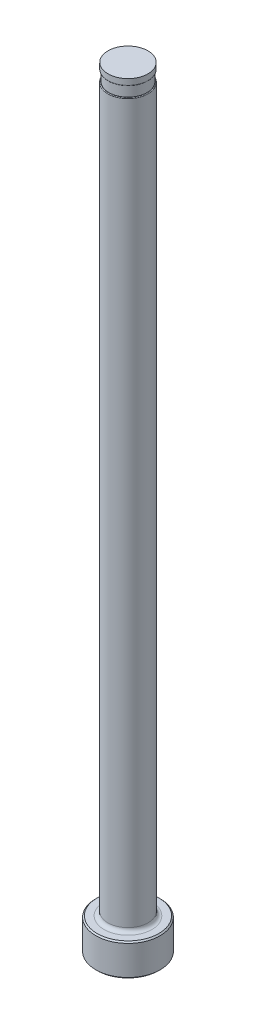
SolidWorks part; units mm, degrees
ref_plane "Front Plane" through (0, 0, 0) normal (0, 0, 1) x (1, 0, 0)
ref_plane "Top Plane" through (0, 0, 0) normal (0, 1, 0) x (1, 0, 0)
ref_plane "Right Plane" through (0, 0, 0) normal (1, 0, 0) x (0, 0, -1)
other "Configuration Table"
sketch "Sketch1" plane through (0, 0, 0) normal (0, 0, 1) x (1, 0, 0)
  line L0 (0, 259.9588) -> (0, -15.1925) construction
  line L1 (0, 0) -> (-6.35, 0)
  line L2 (-6.35, 0) -> (-6.35, 6.35)
  line L3 (-6.35, 6.35) -> (-3.9687, 6.35)
  line L4 (-3.9687, 6.35) -> (-3.9687, 152.4)
  line L5 (-3.9687, 152.4) -> (0, 152.4)
  line L6 (0, 152.4) -> (0, 0)
  dimension "L" = 152.4
  dimension "H" = 12.7
  dimension "T" = 6.35
  dimension "D" = 7.9375
revolve "Revolve1" add sketch "Sketch1" angle 360 about L0
chamfer "Chamfer1" distance 0.254 angle 45 2 edges at (0, 6.35, 6.35) (0, 0, 6.35)
fillet "Fillet1" radius 0.762 1 edges at (0, 6.35, 3.9687)
sketch "Sketch2" plane through (0, 0, 0) normal (0, 0, 1) x (1, 0, 0)
  line L0 (-3.9687, 152.4) -> (-3.9687, 7.112) construction
  line L1 (-3.9687, 151.13) -> (-3.7655, 151.13)
  line L2 (-3.9687, 151.13) -> (-3.9687, 149.098)
  line L3 (-3.9687, 149.098) -> (-3.7655, 149.098)
  line L4 (-3.7655, 151.13) -> (-3.7655, 149.098)
  line L5 (3.9687, 152.4) -> (-3.9687, 152.4) construction
  line L6 (0, 153.4483) -> (0, 147.3282) construction
  dimension "D1" = 2.032
  dimension "N" = 1.27
  dimension "FD" = 0.2032
  dimension "D3" = 7.5311
revolve "Vent Relief" cut sketch "Sketch2" angle 360 about L6
sketch "Sketch3" plane through (0, 0, 0) normal (0, 0, 1) x (1, 0, 0)
  line L0 (-3.7655, 150.114) -> (-3.7655, 86.614)
  line L1 (-3.7655, 151.13) -> (-3.7655, 149.098) construction
  line L2 (-3.9687, 149.098) -> (-3.9687, 7.112) construction
  line L3 (-3.9687, 85.4964) -> (-3.9687, 150.114)
  line L4 (-3.9687, 150.114) -> (-3.7655, 150.114)
  arc A0 (-3.7655, 86.614) -> (-3.9687, 85.4964) centre (-6.9405, 86.614) cw
  dimension "D1" = 3.175
  dimension "D2" = 63.5
extrude "D-Slot" cut sketch "Sketch3" against normal through all both and the other way through all
sketch "Sketch5" plane through (0, 0, 0) normal (0, 0, 1) x (1, 0, 0)
  line L0 (-3.9687, 151.13) -> (3.9687, 151.13) construction
  line L1 (-3.9687, 152.4) -> (-3.9497, 152.4)
  line L2 (-3.9687, 152.4) -> (-3.9687, 151.13)
  line L3 (-3.9687, 151.13) -> (-3.9497, 151.13)
  line L4 (-3.9497, 152.4) -> (-3.9497, 151.13)
  line L5 (0, 152.6877) -> (0, 150.5771) construction
  dimension "VP" = 0.019
revolve "Vent Diameter" cut sketch "Sketch5" angle 360 about L5
fillet "Fillet2" radius 0.127 2 edges at (3.9687, 149.098, 0) (0, 151.13, 3.9497)
sketch "Pocket Sketch" plane through (0, 0, 0) normal (0, 0, 1) x (1, 0, 0)
  line L0 (-6.7469, 0) -> (-6.7469, 6.3754)
  line L1 (-6.7469, 6.3754) -> (-4.9292, 6.3754)
  line L2 (-4.1672, 7.1374) -> (-4.1672, 22.225)
  line L3 (-4.1672, 22.225) -> (0, 22.225)
  line L4 (0, 22.225) -> (0, 0)
  line L5 (0, 0) -> (-6.7469, 0)
  line L6 (0, 12.6104) -> (0, -2.4989) construction
  line L7 (-6.35, 6.096) -> (-6.35, 0.254) construction
  line L8 (6.096, 6.35) -> (-6.096, 6.35) construction
  line L9 (-3.9687, 85.4964) -> (-3.9687, 7.112) construction
  line L10 (-4.9292, 6.3754) -> (-4.1672, 7.1374)
  point P3 (-4.1672, 6.3754)
  dimension "D1" = 13.4937
  dimension "D2" = 0.3969
  dimension "D3" = 0.0254
  dimension "D4" = 0.1984
  dimension "D5" = 8.3344
  dimension "D6" = 22.225
